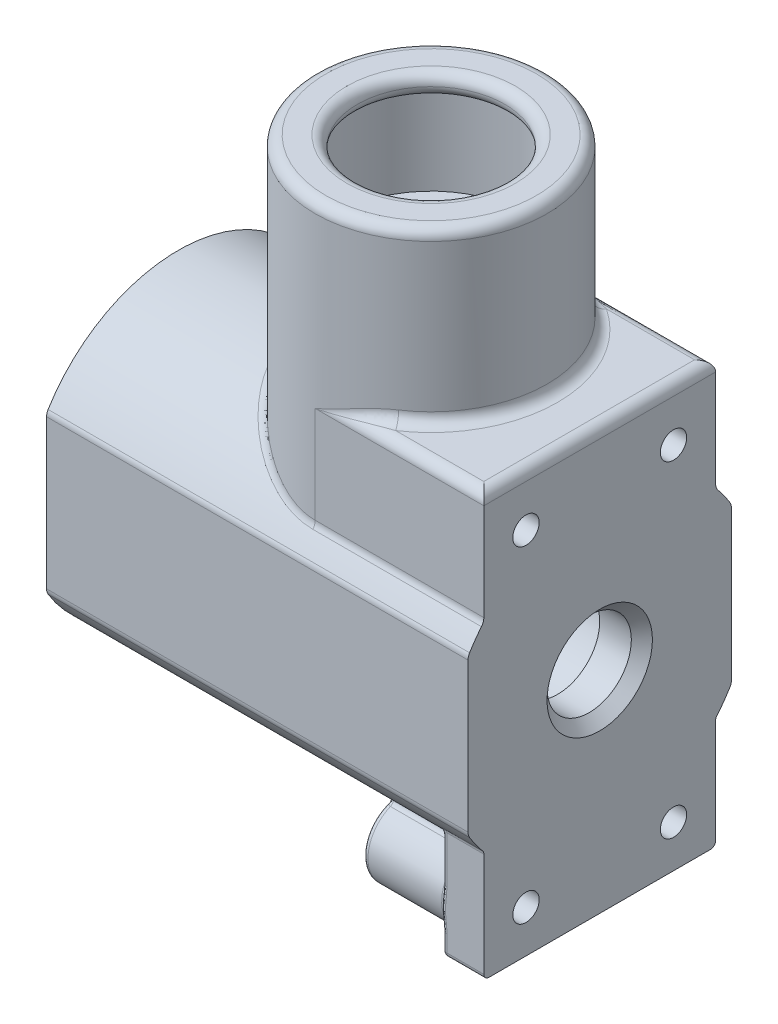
SolidWorks part; units mm, degrees
ref_plane "Plan de face" through (0, 0, 0) normal (0, 0, 1) x (1, 0, 0)
ref_plane "Plan de dessus" through (0, 0, 0) normal (0, 1, 0) x (1, 0, 0)
ref_plane "Plan de droite" through (0, 0, 0) normal (1, 0, 0) x (0, 0, -1)
sketch "Esquisse1" plane through (0, 0, 0) normal (1, 0, 0) x (0, 0, -1)
  line L0 (-12.5, 7.3485) -> (-12.5, -7.3485)
  line L1 (12.5, 7.3485) -> (12.5, -7.3485)
  arc A0 (-12.5, -7.3485) -> (12.5, -7.3485) centre (0, 0) ccw
  arc A1 (12.5, 7.3485) -> (-12.5, 7.3485) centre (0, 0) ccw
  dimension "D1" = 29
  dimension "D2" = 12.5
  dimension "D3" = 25
extrude "Extrusion1" add sketch "Esquisse1" along normal blind 40
ref_plane "Plan1" through (0, 36, 0) normal (0, 1, 0) x (-1, 0, 0)
sketch "Esquisse2" plane through (0, 36, 0) normal (0, 1, 0) x (-1, 0, 0)
  line L0 (-40, 0) -> (0, 0) construction
  line L1 (0, -12.5) -> (0, 12.5) construction
  circle A0 centre (-24, 0) radius 11
  dimension "D1" = 22
  dimension "D2" = 24
extrude "Extrusion2" add sketch "Esquisse2" against normal up to surface (26.5528 mm away)
sketch "Esquisse3" plane through (40, 0, 0) normal (1, 0, 0) x (0, 0, -1)
  line L0 (-11, 20) -> (11, 20)
  line L1 (11, 20) -> (11, 9.4472)
  line L2 (-11, 20) -> (-11, 9.4472)
  line L3 (0, 9.4473) -> (0, 36) construction
  arc A0 (12.5, 7.3485) -> (-12.5, 7.3485) centre (0, 0) ccw construction
  arc A1 (11, 9.4472) -> (-11, 9.4472) centre (0, 0) ccw
  dimension "D1" = 11
  dimension "D2" = 11
  dimension "D3" = 20
extrude "Extrusion3" add sketch "Esquisse3" against normal up to surface (16 mm away)
sketch "Esquisse4" plane through (40, 0, 0) normal (1, 0, 0) x (0, 0, -1)
  line L0 (-11, -9.4472) -> (-11, -20)
  line L2 (11, -9.4472) -> (11, -20)
  line L4 (-11, -20) -> (11, -20)
  arc A0 (-12.5, -7.3485) -> (12.5, -7.3485) centre (0, 0) ccw construction
  arc A1 (-11, -9.4472) -> (11, -9.4472) centre (0, 0) ccw
  dimension "D1" = 20
extrude "Extrusion4" add sketch "Esquisse4" against normal blind 4
sketch "Esquisse5" plane through (36, 0, 0) normal (-1, 0, 0) x (0, 0, 1)
  line L0 (11, -20) -> (-11, -20) construction
  line L1 (11, -9.4472) -> (11, -20) construction
  line L2 (-11, -20) -> (-11, -9.4472) construction
  circle A0 centre (7, -16) radius 3.5
  circle A1 centre (-7, -16) radius 3.5
  dimension "D1" = 7
  dimension "D2" = 7
  dimension "D4" = 4
  dimension "D5" = 4
  dimension "D6" = 4
  dimension "D3" = 4
extrude "Extrusion5" add sketch "Esquisse5" along normal blind 8
fillet "Congé1" radius 1 8 edges at (32, 9.4472, -11) (32, 9.4472, 11) (34.9965, 14.4973, 0.2777) (40, 20, 0) (32, 20, -11) (35, 20, 0) (32, 20, 11) (24, 36, 11)
fillet "Congé5" radius 0.5 9 edges at (32, -12.5149, 7.323) (32, -13.8719, 4.2213) (32, -13.8719, -4.2213) (32, -12.5149, -7.323) (36, -11.1339, -9.289) (36, -14.5, 0) (36, -11.1339, 9.289) (36, -19.2066, 8.4029) (36, -19.2066, -8.4029)
fillet "Congé6" radius 0.5 21 edges at (35.8288, -9.6354, -11) (35.7342, -9.5364, 11) (36, -18, 11) (36, -13.099, -11) (36, -18, -11) (36, -20, -9) (36, -20, 9) (36, -20, 0) (36, -13.099, 11) (37.75, -9.4472, 11) (28, -14.3165, 3.6112) (28, -12.3687, 8.0635) (28, -12.3687, -8.0635) (28, -14.3165, -3.6112) (28, -19.2066, 8.4029) (28, -19.2066, -8.4029) (38, -20, 11) (38, -20, -11) (37.75, -9.4472, -11) (28, -13.2843, 5.8119) (28, -13.2843, -5.8119)
fillet "Congé8" radius 1 4 edges at (20, -7.3485, -12.5) (20, 7.3485, -12.5) (20, -7.3485, 12.5) (20, 7.3485, 12.5)
sketch "Esquisse6" plane through (0, 0, 0) normal (0, 0, 1) x (1, 0, 0)
  line L0 (0, 10) -> (15.5, 10)
  line L1 (0, 14.5) -> (0, 7.5949) construction
  line L2 (15.5, 10) -> (15.5, 11.5)
  line L3 (15.5, 11.5) -> (17, 11.5)
  line L4 (17, 11.5) -> (17, 7)
  line L6 (17, 7) -> (30, 7)
  line L7 (30, 7) -> (30, 4.5)
  line L8 (30, 4.5) -> (31, 4.5)
  line L9 (31, 4.5) -> (31, 6)
  line L10 (31, 6) -> (36, 6)
  line L11 (36, 6) -> (36, 4)
  line L12 (36, 4) -> (40, 4)
  line L13 (40, 7.0711) -> (40, -7.0711) construction
  line L14 (-5.8428, 0) -> (42.9391, 0) construction
  line L15 (40, 0) -> (0, 0) construction
  line L16 (0, 10) -> (0, 0)
  line L17 (40, 4) -> (40, 0)
  line L18 (40, 0) -> (0, 0)
  dimension "D1" = 4
  dimension "D2" = 5
  dimension "D3" = 1
  dimension "D4" = 14
  dimension "D5" = 1.5
  dimension "D6" = 15.5
  dimension "D7" = 20
  dimension "D8" = 23
  dimension "D9" = 9
  dimension "D10" = 12
  dimension "D11" = 8
revolve "Enlèvement de matière-Révolution2" cut sketch "Esquisse6" angle 360 about L14
chamfer "Chanfrein1" distance 1 angle 45 2 edges at (40, 0, 4) (17, 0, 7)
sketch "Esquisse7" plane through (0, 0, 0) normal (0, 0, 1) x (1, 0, 0)
  line L0 (24, 38.5171) -> (24, 1.3259) construction
  line L1 (24, 21) -> (24, 35) construction
  line L2 (17, 36) -> (17, 34)
  line L3 (14.464, 36) -> (-14.464, 36) construction
  line L4 (17, 34) -> (15, 34)
  line L5 (15, 34) -> (15, 25)
  line L6 (15, 25) -> (16.5, 25)
  line L7 (16.5, 25) -> (16.5, 17)
  line L8 (16.5, 17) -> (18.5, 14.5711)
  line L9 (18.5, 14.5711) -> (18.5, 9.5711)
  line L10 (18.5, 9.5711) -> (21, 9.5711)
  line L11 (21, 9.5711) -> (21, 5.6077)
  line L13 (21, 5.6077) -> (24, 5.6077)
  line L14 (17, 36) -> (24, 36)
  line L15 (24, 5.6077) -> (24, 36)
  dimension "D1" = 2
  dimension "D2" = 9
  dimension "D3" = 8
  dimension "D5" = 5
  dimension "D6" = 14
  dimension "D7" = 18
  dimension "D8" = 15
  dimension "D9" = 11
  dimension "D10" = 6
revolve "Enlèvement de matière-Révolution3" cut sketch "Esquisse7" angle 360 about L0
hole_wizard "Trou taraudé M31" positions "Esquisse3D1" profile "Esquisse8" tap size "M3" standard "ISO"
sketch3d "Esquisse3D1"
  line L0 (40, -20, 10.5) -> (40, -20, -10.5) construction
  line L1 (40, -9.6307, 11) -> (40, -19.5, 11) construction
  point P0 (40, -16, 7)
  dimension "D1" = 4
  dimension "D2" = 4
sketch "Esquisse8" plane through (40, -16, 7) normal (0, 1, 0) x (0, 0, -1)
  line L0 (0, 0) -> (0, 10.2511)
  line L1 (0, 10.2511) -> (1.25, 9.5)
  line L2 (1.25, 9.5) -> (1.25, 0)
  line L5 (1.25, 0) -> (0, 0)
  line L10 (0, 10.2511) -> (-1.25, 9.5) construction
  line L11 (0, -6.35) -> (0, 107.95) construction
  dimension "Diamètre du trou pour taraudage" = 2.5
  dimension "Profondeur du trou pour taraudage" = 9.5
  dimension "Angle de pointe" = 118
pattern_linear "Répétition linéaire1" count 2 spacing 14 along (0, 0, -1) count 2 spacing 31 along (0, 1, 0) of "Trou taraudé M31"
fillet "Congé9" radius 1 2 edges at (24, 34, 7) (24, 36, 7)
sketch "Esquisse9" plane through (0, 0, 0) normal (0, 1, 0) x (1, 0, 0)
  line L1 (-0.9502, 0) -> (41.355, 0)
  line L2 (-0.9502, 0) -> (-0.9502, -13.7981)
  line L3 (-0.9502, -13.7981) -> (41.355, -13.7981)
  line L4 (41.355, 0) -> (41.355, -13.7981)
extrude "Enlèv. mat.-Extru.1" cut sketch "Esquisse9" against normal through all and the other way through all
